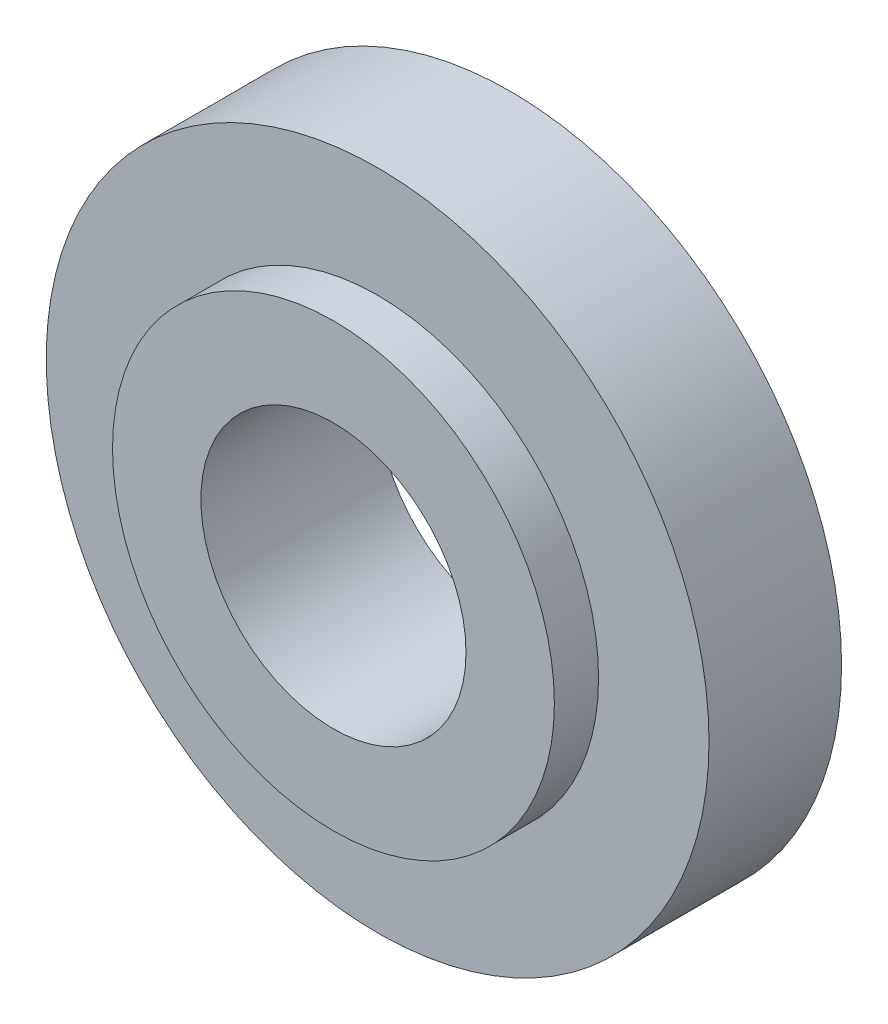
SolidWorks part; units mm, degrees
ref_plane "Plan de face" through (0, 0, 0) normal (0, 0, 1) x (1, 0, 0)
ref_plane "Plan de dessus" through (0, 0, 0) normal (0, 1, 0) x (1, 0, 0)
ref_plane "Plan de droite" through (0, 0, 0) normal (1, 0, 0) x (0, 0, -1)
sketch "Esquisse1" plane through (0, 0, 0) normal (0, 0, 1) x (1, 0, 0)
  circle A0 centre (0, 0) radius 3.75
  dimension "D1" = 7.5
extrude "Boss.-Extru.1" add sketch "Esquisse1" along normal blind 1.5
sketch "Esquisse2" plane through (0, 0, 1.5) normal (0, 0, 1) x (1, 0, 0)
  circle A0 centre (0, 0) radius 1.5
  dimension "D1" = 3
extrude "Enlèv. mat.-Extru.1" cut sketch "Esquisse2" against normal through all
sketch "Esquisse4" plane through (0, 0, 1.5) normal (0, 0, 1) x (1, 0, 0)
  circle A0 centre (0, 0) radius 2.5
  circle A1 centre (0, 0) radius 1.5 construction
  circle A2 centre (0, 0) radius 1.5
  dimension "D1" = 5
extrude "Boss.-Extru.3" add sketch "Esquisse4" along normal blind 0.5
